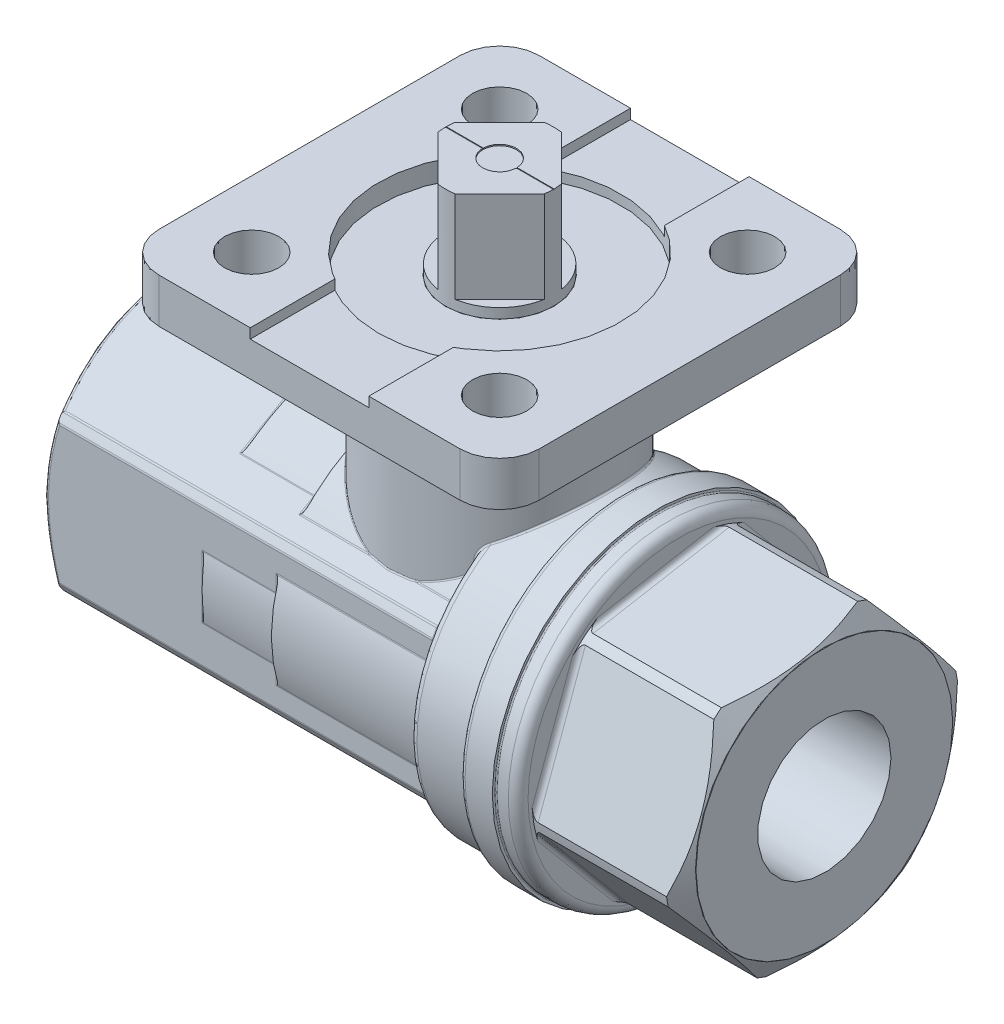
SolidWorks part; units mm, degrees
ref_plane "Front Plane" through (0, 0, 0) normal (0, 0, 1) x (1, 0, 0)
ref_plane "Top Plane" through (0, 0, 0) normal (0, 1, 0) x (1, 0, 0)
ref_plane "Right Plane" through (0, 0, 0) normal (1, 0, 0) x (0, 0, -1)
sketch "Sketch29" plane through (0, 0, 0) normal (0, 0, 1) x (1, 0, 0)
  line L0 (-22.4561, 0) -> (28.9413, 0) construction
  line L1 (-11.501, 4.953) -> (11.501, 4.953)
  arc A0 (11.6172, 5.1313) -> (-11.6172, 5.1313) centre (0, 0) ccw
  arc A1 (11.501, 4.953) -> (11.6172, 5.1313) centre (11.501, 5.08) ccw
  arc A2 (-11.6172, 5.1313) -> (-11.501, 4.953) centre (-11.501, 5.08) ccw
  dimension "D1" = 25.4
  dimension "D3" = 0.127
  dimension "D2" = 9.906
revolve "Revolve2" [suppressed] add sketch "Sketch29" angle 360 about L0
sketch "Sketch32" plane through (0, 0, 0) normal (0, 0, 1) x (1, 0, 0)
  line L0 (-48.2342, 0) -> (54.7586, 0) construction
  line L1 (-12.7, 0) -> (12.7, 0)
  arc A0 (12.7, 0) -> (-12.7, 0) centre (0, 0) ccw
  dimension "D1" = 25.4
revolve "Revolve3" add sketch "Sketch32" angle 360 about L0
sketch "Sketch1" plane through (0, 0, 0) normal (0, 0, 1) x (1, 0, 0)
  line L0 (-175.6553, 0) -> (165.9362, 0) construction
  line L1 (0, 145.328) -> (0, -131.1123) construction
  line L19 (-33.401, 13.208) -> (-33.401, 4.953)
  line L20 (-32.131, 4.953) -> (-11.6172, 4.953)
  line L22 (33.401, 13.208) -> (33.401, 4.953)
  line L23 (18.415, 15.494) -> (18.415, 15.113)
  line L25 (-33.401, 145.328) -> (-33.401, -131.1123) construction
  line L27 (12.827, 16.383) -> (12.827, 16.129)
  line L28 (6.731, 15.24) -> (6.731, 14.224)
  line L29 (12.7, 16.002) -> (7.493, 16.002)
  line L30 (17.399, 16.51) -> (16.256, 16.51)
  line L31 (16.129, 16.891) -> (13.335, 16.891)
  line L33 (18.415, 15.113) -> (32.131, 15.113)
  line L34 (16.129, 16.891) -> (16.129, 16.637)
  line L35 (-9.271, 14.224) -> (-9.271, 13.716)
  line L37 (-16.891, 13.716) -> (-9.271, 13.716)
  line L38 (-9.271, 14.224) -> (6.731, 14.224)
  line L39 (-32.131, 15.113) -> (-16.891, 15.113)
  line L40 (-16.891, 15.113) -> (-16.891, 13.716)
  line L41 (-33.401, 4.953) -> (-33.401, 0)
  line L42 (-33.401, 0) -> (-32.131, 0)
  line L43 (-32.131, 4.953) -> (-32.131, 0)
  line L44 (33.401, 4.953) -> (33.401, 0)
  line L45 (33.401, 0) -> (32.131, 0)
  line L46 (32.131, 0) -> (32.131, 4.953)
  line L47 (33.401, 13.208) -> (33.3502, 13.208)
  line L48 (33.3502, 13.208) -> (32.131, 15.113)
  line L49 (-33.3502, 13.208) -> (-32.131, 15.113)
  line L50 (-33.401, 13.208) -> (-33.3502, 13.208)
  line L51 (-11.6172, 5.1313) -> (11.6172, 5.1313)
  line L52 (11.6172, 5.1313) -> (11.6172, 4.953)
  line L53 (-11.6172, 5.1313) -> (-11.6172, 4.953)
  line L54 (11.6172, 4.953) -> (32.131, 4.953)
  arc A12 (18.415, 15.494) -> (17.399, 16.51) centre (17.399, 15.494) ccw
  arc A13 (12.827, 16.383) -> (13.335, 16.891) centre (13.335, 16.383) cw
  arc A14 (6.731, 15.24) -> (7.493, 16.002) centre (7.493, 15.24) cw
  arc A15 (16.129, 16.637) -> (16.256, 16.51) centre (16.256, 16.637) ccw
  arc A16 (12.827, 16.129) -> (12.7, 16.002) centre (12.7, 16.129) cw
  point P18 (33.401, 9.0805)
  point P19 (18.415, 16.51)
  dimension "D8" = 14.986
  dimension "D12" = 6.096
  dimension "D1" = 33.401
  dimension "D5" = 33.02
  dimension "D11" = 32.004
  dimension "D14" = 1.016
  dimension "D15" = 0.508
  dimension "D16" = 0.762
  dimension "D17" = 0.127
  dimension "D4" = 13.208
  dimension "D7" = 2.286
  dimension "D9" = 3.302
  dimension "D3" = 30.226
  dimension "D6" = 33.782
  dimension "D10" = 12.827
  dimension "D2" = 9.906
  dimension "D18" = 16.51
  dimension "D19" = 24.13
  dimension "D20" = 27.432
  dimension "D21" = 0.508
  dimension "D22" = 0.0508
revolve "Revolve1" add sketch "Sketch1" angle 360 about L0
sketch "Sketch2" plane through (33.401, 0, 0) normal (1, 0, 0) x (0, 0, -1)
  line L0 (0, 39.7746) -> (0, -20.8328) construction
  line L1 (15.164, 2.6738) -> (5.2664, 14.4693)
  line L2 (5.2664, 14.4693) -> (-9.8976, 11.7955)
  line L3 (-9.8976, 11.7955) -> (-15.164, -2.6738)
  line L4 (-15.164, -2.6738) -> (-5.2664, -14.4693)
  line L5 (-5.2664, -14.4693) -> (9.8976, -11.7955)
  line L6 (9.8976, -11.7955) -> (15.164, 2.6738)
  line L7 (-41.623, 0) -> (41.4448, 0) construction
  circle A0 centre (0, 0) radius 13.335 construction
  dimension "D1" = 26.67
extrude "right hex" cut sketch "Sketch2" against normal up to surface (14.986 mm away) flip side to cut
fillet "Fillet1" radius 0.508 6 edges at (18.415, 13.1324, 2.3156) (18.415, 4.5608, 12.5308) (18.415, -8.5716, 10.2152) (18.415, -13.1324, -2.3156) (18.415, -4.5608, -12.5308) (18.415, 8.5716, -10.2152)
ref_plane "Plane4" through (-16.891, 0, 0) normal (-1, 0, 0) x (0, 0, 1)
sketch "Sketch3" plane through (-16.891, 0, 0) normal (-1, 0, 0) x (0, 0, 1)
  line L0 (-37.7875, 0) -> (28.9701, 0) construction
  line L1 (-0.5083, 15.1044) -> (-12.8267, 7.9924)
  line L8 (-13.335, 7.112) -> (-13.335, -7.112)
  line L9 (-12.8267, -7.9924) -> (-0.5083, -15.1044)
  line L10 (0.5083, -15.1044) -> (12.8267, -7.9924)
  line L11 (13.335, -7.112) -> (13.335, 7.112)
  line L12 (12.8267, 7.9924) -> (0.5083, 15.1044)
  circle A0 centre (0, 0) radius 13.335 construction
  circle A1 centre (0, 0) radius 4.953 construction
  arc A2 (-12.8267, 7.9924) -> (-13.335, 7.112) centre (0, 0) ccw
  arc A3 (-13.335, -7.112) -> (-12.8267, -7.9924) centre (0, 0) ccw
  arc A4 (-0.5083, -15.1044) -> (0.5083, -15.1044) centre (0, 0) ccw
  arc A5 (12.8267, -7.9924) -> (13.335, -7.112) centre (0, 0) ccw
  arc A6 (13.335, 7.112) -> (12.8267, 7.9924) centre (0, 0) ccw
  arc A7 (0.5083, 15.1044) -> (-0.5083, 15.1044) centre (0, 0) ccw
  circle A8 centre (0, 0) radius 13.208
  dimension "D1" = 26.67
  dimension "D2" = 15.113
  dimension "D3" = 26.416
extrude "left body" add sketch "Sketch3" against normal up to surface (23.622 mm away)
sketch "Sketch27" plane through (-33.401, 0, 0) normal (-1, 0, 0) x (0, 0, 1)
  line L1 (0, 15.3979) -> (-13.335, 7.699)
  line L2 (-13.335, 7.699) -> (-13.335, -7.699)
  line L3 (-13.335, -7.699) -> (0, -15.3979)
  line L4 (0, -15.3979) -> (13.335, -7.699)
  line L5 (13.335, -7.699) -> (13.335, 7.699)
  line L6 (13.335, 7.699) -> (0, 15.3979)
  circle A0 centre (0, 0) radius 13.335 construction
  circle A1 centre (0, 0) radius 4.953 construction
  dimension "D1" = 26.67
extrude "left hex" cut sketch "Sketch27" against normal blind 16.51 flip side to cut
hole_wizard "1/4 NPT Tapped Hole1" positions "3DSketch2" profile "Sketch28" size "1/4" standard "ANSI Inch"
sketch3d "3DSketch2"
  point P0 (33.401, 0, 0)
  point P4 (-33.401, 0, 0)
sketch "Sketch28" plane through (33.401, 0, 0) normal (0, 1, 0) x (0, 0, -1)
  line L0 (0, 0) -> (0, 20.3603)
  line L1 (5.5626, 17.018) -> (0, 20.3603)
  line L2 (-5.5626, 17.018) -> (0, 20.3603) construction
  line L3 (5.5626, 17.018) -> (5.5626, 9.906)
  line L4 (5.5626, 9.906) -> (6.558, 9.906)
  line L5 (6.558, 9.906) -> (6.8546, 0)
  line L6 (-6.558, 9.906) -> (-6.8546, 0) construction
  line L7 (6.8546, 0) -> (0, 0)
  line L8 (0, -6.35) -> (0, 107.95) construction
  line L11 (-5.5626, 9.906) -> (-6.558, 9.906) construction
  dimension "Tap Drill Dia." = 11.1252
  dimension "Tap Drill Depth" = 17.018
  dimension "Thread Dia." = 13.7092
  dimension "Thread Angle" = 3.43
  dimension "Thread Depth" = 9.906
  dimension "Drill Angle" = 118
fillet "Fillet3" radius 0.381 14 edges at (-9.271, 0, 13.716) (-16.891, 0, 13.716) (-12.7, 7.112, 13.335) (6.731, 7.5565, 13.0882) (-9.271, 4.0801, 13.335) (-13.081, 3.2104, 13.335) (-13.081, -3.2104, 13.335) (-9.271, -4.0801, 13.335) (-1.27, -4.9497, 13.335) (-1.27, 4.9497, 13.335) (6.731, -7.5565, 13.0882) (-12.7, -7.112, 13.335) (-16.891, 0, 13.335)
fillet "Fillet4" radius 0.381 17 edges at (6.731, -8.4665, 12.0056) (-9.271, -11.8784, 6.858) (-16.891, -11.8784, 6.858) (6.731, -14.5639, 1.4446) (-9.271, -9.5084, 10.2009) (-13.081, -9.9433, 9.4478) (-13.081, -13.1536, 3.8872) (-9.271, -13.5885, 3.1341) (-1.27, -14.0233, 2.3809) (-1.27, -9.0736, 10.9541) (6.731, -15.113, 0) (-12.7, -15.1044, 0.5083) (-16.891, -11.5484, 6.6675) (-33.2388, -12.1091, 5.6964) (-12.8762, -7.9924, 12.8267) (6.5881, -7.9262, 12.9414)
fillet "Fillet5" radius 0.381 17 edges at (6.731, -14.6304, -1.3294) (-9.271, -11.8784, -6.858) (-16.891, -11.8784, -6.858) (6.731, -8.533, -11.8904) (-9.271, -13.5885, -3.1341) (-13.081, -13.1536, -3.8872) (-13.081, -9.9433, -9.4478) (-9.271, -9.5084, -10.2009) (-1.27, -9.0736, -10.9541) (-1.27, -14.0233, -2.3809) (6.731, -7.5565, -13.0882) (-12.7, -7.9924, -12.8267) (-16.891, -11.5484, -6.6675) (-33.2388, -10.9878, -7.6386) (-12.8762, -15.1044, -0.5083) (6.5881, -15.1707, -0.3936)
fillet "Fillet6" radius 0.381 17 edges at (6.731, -6.1639, -13.335) (-9.271, 0, -13.716) (-16.891, 0, -13.716) (6.731, 6.0309, -13.335) (6.731, 7.5565, -13.0882) (-12.7, 7.112, -13.335) (-9.271, -4.0801, -13.335) (-13.081, -3.2104, -13.335) (-13.081, 3.2104, -13.335) (-9.271, 4.0801, -13.335) (-1.27, 4.9497, -13.335) (-1.27, -4.9497, -13.335) (-16.891, 0, -13.335) (-12.8762, -7.112, -13.335) (6.5881, -7.2445, -13.335)
fillet "Fillet7" radius 0.381 14 edges at (6.731, 15.113, 0) (-16.891, 11.5484, -6.6675) (-13.081, 9.9433, -9.4478) (-13.081, 13.1536, -3.8872) (-9.271, 9.5084, -10.2009) (-9.271, 13.5885, -3.1341) (-1.27, 9.0736, -10.9541) (-1.27, 14.0233, -2.3809) (6.731, 14.5639, -1.4446) (-12.7, 15.1044, -0.5083) (-12.8762, 7.9924, -12.8267) (6.731, 8.4665, -12.0056) (-33.2388, 12.1091, -5.6964)
fillet "Fillet8" radius 0.381 14 edges at (-16.891, 11.5484, 6.6675) (-13.081, 13.1536, 3.8872) (-13.081, 9.9433, 9.4478) (-9.271, 13.5885, 3.1341) (-9.271, 9.5084, 10.2009) (-1.27, 14.0233, 2.3809) (-1.27, 9.0736, 10.9541) (6.731, 14.6304, 1.3294) (6.731, 8.4665, 12.0056) (-12.8762, 7.9924, 12.8267) (-12.8762, 15.1044, 0.5083) (-33.2388, 10.9878, 7.6386)
sketch "Sketch13" plane through (0, 0, 0) normal (0, 0, 1) x (1, 0, 0)
  line L0 (0, 45.1804) -> (0, 35.5994) construction
  line L1 (-74.8163, 0) -> (65.8434, 0) construction
  line L4 (-5.588, 7.62) -> (-11.176, 7.62)
  line L5 (-11.176, 31.75) -> (-11.176, 7.62)
  line L6 (-5.588, 31.75) -> (-11.176, 31.75)
  line L12 (-5.588, 31.75) -> (-5.588, 7.62)
  line L13 (0, 35.5994) -> (0, -45.9387) construction
  dimension "D1" = 11.176
  dimension "D2" = 11.176
  dimension "D4" = 7.62
  dimension "D6" = 31.75
revolve "stemtower" add sketch "Sketch13" angle 360 about L0
sketch "Sketch14" plane through (0, 31.75, 0) normal (0, 1, 0) x (1, 0, 0)
  line L0 (0, 26.658) -> (0, -28.9984) construction
  line L1 (-44.2472, 0) -> (48.3428, 0) construction
  line L3 (-9.5191, 9.5191) -> (0, 0) construction
  arc A3 (-12.2537, 8.6271) -> (-8.6271, 12.2537) centre (-11.7641, 11.7641) ccw
  arc A4 (-8.6271, 12.2537) -> (-12.2537, 8.6271) centre (0, 0) ccw
  arc A5 (12.2537, 8.6271) -> (8.6271, 12.2537) centre (0, 0) ccw
  arc A6 (8.6271, 12.2537) -> (12.2537, 8.6271) centre (11.7641, 11.7641) ccw
  arc A7 (8.6271, -12.2537) -> (12.2537, -8.6271) centre (0, 0) ccw
  arc A8 (12.2537, -8.6271) -> (8.6271, -12.2537) centre (11.7641, -11.7641) ccw
  arc A9 (-12.2537, -8.6271) -> (-8.6271, -12.2537) centre (0, 0) ccw
  arc A10 (-8.6271, -12.2537) -> (-12.2537, -8.6271) centre (-11.7641, -11.7641) ccw
  point P22 (0, 0)
  dimension "D1" = 6.35
  dimension "D2" = 14.986
  dimension "D4" = 19.0381
  dimension "D5" = 4
  dimension "D3" = 13.462
  dimension "D6" = 11.7641
sketch "Sketch15" plane through (0, 31.75, 0) normal (0, 1, 0) x (1, 0, 0)
  line L0 (-43.4427, 0) -> (49.8056, 0) construction
  line L1 (15.494, 19.558) -> (-15.494, 19.558)
  line L2 (19.558, 15.494) -> (19.558, -8.763)
  line L3 (15.494, -19.558) -> (0, -19.558)
  line L4 (-19.558, 15.494) -> (-19.558, -15.494)
  line L5 (0, 24.9028) -> (0, -27.17) construction
  line L6 (19.558, -8.763) -> (19.558, -15.494)
  line L9 (0, -19.558) -> (-15.494, -19.558)
  line L15 (-15.494, 15.494) -> (-9.0727, 9.0727) construction
  line L26 (-9.0727, 9.0727) -> (7.0566, -7.0566) construction
  arc A0 (-19.558, -15.494) -> (-15.494, -19.558) centre (-15.494, -15.494) ccw
  arc A1 (15.494, -19.558) -> (19.558, -15.494) centre (15.494, -15.494) ccw
  arc A2 (19.558, 15.494) -> (15.494, 19.558) centre (15.494, 15.494) ccw
  arc A3 (-15.494, 19.558) -> (-19.558, 15.494) centre (-15.494, 15.494) ccw
  circle A20 centre (-12.752, 12.752) radius 2.794
  circle A21 centre (12.752, 12.752) radius 2.794
  circle A22 centre (12.752, -12.752) radius 2.794
  circle A23 centre (-12.752, -12.752) radius 2.794
  circle A31 centre (0, 0) radius 5.588
  circle A32 centre (0, 0) radius 18.034 construction
  point P31 (0, 0)
  point P36 (-8.636, -19.558)
  point P70 (0, 0)
  point P116 (0, 0)
  dimension "D5" = 4.064
  dimension "D7" = 11.176
  dimension "D6" = 4
  dimension "D1" = 39.116
  dimension "D2" = 39.116
  dimension "D3" = 19.558
  dimension "D4" = 19.558
  dimension "D23" = 45
extrude "pad" add sketch "Sketch15" against normal blind 4.572
sketch "Sketch16" plane through (0, 31.75, 0) normal (0, 1, 0) x (1, 0, 0)
  line L0 (-6.096, 21.082) -> (6.096, 21.082)
  line L1 (-6.096, 10.5219) -> (6.096, 10.5219)
  line L2 (-6.096, 10.5219) -> (-6.096, 21.082)
  line L4 (6.096, 10.5219) -> (6.096, 21.082)
  line L5 (-6.096, -10.5219) -> (-6.096, -21.082)
  line L6 (0, 25.7804) -> (0, -27.5357) construction
  line L7 (-42.2726, 0) -> (47.3189, 0) construction
  line L8 (-6.096, -10.5219) -> (6.096, -10.5219)
  line L9 (6.096, -10.5219) -> (6.096, -21.082)
  line L10 (-6.096, -21.082) -> (6.096, -21.082)
  dimension "D1" = 21.082
  dimension "D2" = 6.096
  dimension "D3" = 6.096
sketch "Sketch17" plane through (0, 31.75, 0) normal (0, 1, 0) x (1, 0, 0)
  line L0 (0, 25.4147) -> (0, -23.7326) construction
  line L1 (-43.589, 0) -> (47.0264, 0) construction
  circle A0 centre (0, 0) radius 12.446
  circle A1 centre (0, 0) radius 5.588
  dimension "D1" = 24.892
  dimension "D2" = 11.176
extrude "relief-pad" cut sketch "Sketch17" against normal blind 2.032
sketch "Sketch19" plane through (0, 29.718, 0) normal (0, 1, 0) x (1, 0, 0)
  line L0 (0, 38.5482) -> (0, -39.2561) construction
  line L1 (-0.885, 5.479) -> (-5.479, 0.885)
  line L2 (0.885, 5.479) -> (5.479, 0.885)
  line L3 (5.479, -0.885) -> (0.885, -5.479)
  line L4 (-5.479, -0.885) -> (-0.885, -5.479)
  line L5 (-44.7702, 0) -> (43.5927, 0) construction
  arc A0 (0.885, 5.479) -> (-0.885, 5.479) centre (0, 0) ccw
  arc A1 (-5.479, 0.885) -> (-5.479, -0.885) centre (0, 0) ccw
  arc A2 (-0.885, -5.479) -> (0.885, -5.479) centre (0, 0) ccw
  arc A3 (5.479, -0.885) -> (5.479, 0.885) centre (0, 0) ccw
  dimension "D1" = 9
  dimension "D2" = 9
extrude "Boss-Extrude4" add sketch "Sketch19" along normal blind 10.414
sketch "Sketch20" plane through (0, 29.718, 0) normal (0, 1, 0) x (1, 0, 0)
  circle A0 centre (0, 0) radius 5.55
extrude "Cut-Extrude12" cut sketch "Sketch16" against normal blind 1.016
extrude "Boss-Extrude7" add sketch "Sketch20" along normal blind 1.016 contours A0
fillet "Fillet9" radius 1.778 1 edges at (-11.176, 27.178, 0)
fillet "Fillet10" radius 0.1778 24 edges at (6.731, 11.7169, 8.9217) (6.731, 11.7169, -8.9217) (6.8808, 12.9898, 8.8067) (6.9506, 13.1249, -8.7517) (4.5378, 9.9, -10.2133) (2.2605, 9.0896, -10.945) (0, 8.9455, -11.176) (-10.9482, 14.1019, -2.2448) (-11.1637, 15.0872, -0.5238) (11.0653, 15.0313, -1.5692) (-11.1634, 15.0849, 0.5302) (0, 8.9455, 11.176) (11.048, 15.9129, 1.6863) (-6.8148, 11.1292, -8.8579) (-10.9482, 14.1019, 2.2448) (-4.7394, 9.9941, 10.1213)
sketch "Sketch30" plane through (0, 40.132, 0) normal (0, 1, 0) x (1, 0, 0)
  line L0 (-5.55, 0) -> (5.55, 0) construction
  line L1 (-5.5498, -0.0508) -> (5.5498, -0.0508)
  line L2 (-5.5498, 0.0508) -> (5.5498, 0.0508)
  line L3 (-44.7345, 0.0508) -> (50.0335, 0.0508) construction
  line L4 (-44.7345, 0) -> (50.0335, 0) construction
  line L5 (-44.7345, -0.0508) -> (50.0335, -0.0508) construction
  arc A0 (5.5498, -0.0508) -> (5.5498, 0.0508) centre (0, 0) ccw
  arc A1 (-5.5498, 0.0508) -> (-5.5498, -0.0508) centre (0, 0) ccw
  dimension "D1" = 0.0508
  dimension "D2" = 0.0508
extrude "Cut-Extrude13" cut sketch "Sketch30" against normal blind 0.0508
sketch "Sketch31" plane through (0, 40.132, 0) normal (0, 1, 0) x (1, 0, 0)
  circle A0 centre (0, 0) radius 1.7385
extrude "Cut-Extrude14" cut sketch "Sketch31" against normal blind 0.127
